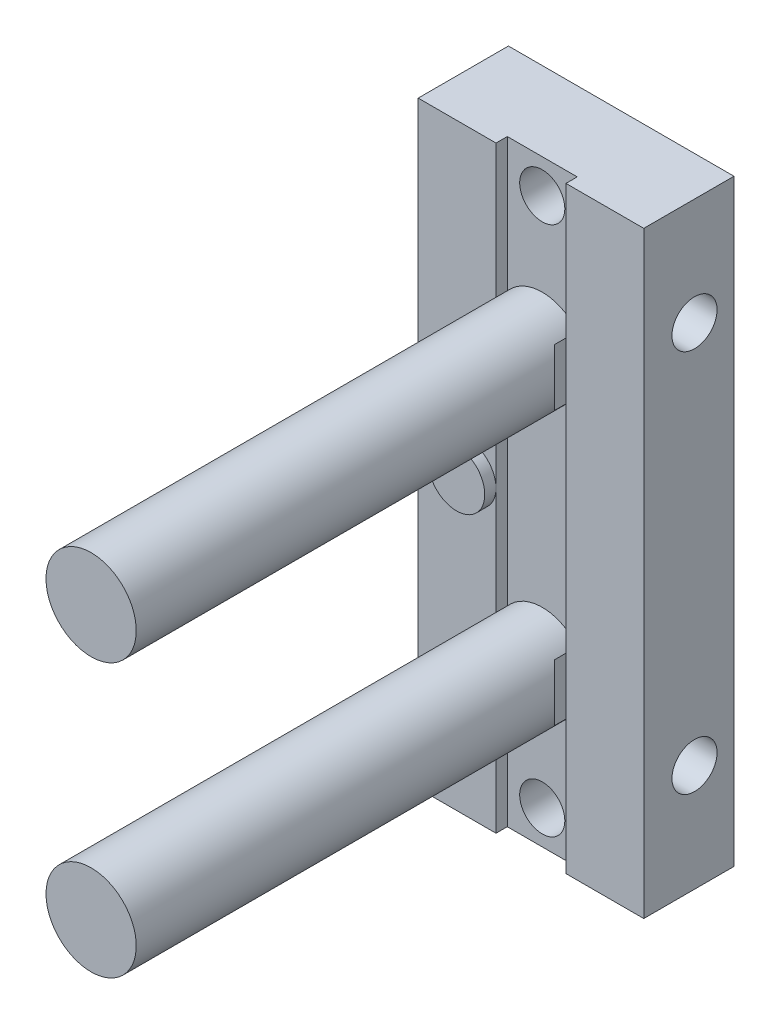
SolidWorks part; units mm, degrees
ref_plane "前视基准面" through (0, 0, 0) normal (0, 0, 1) x (1, 0, 0)
ref_plane "上视基准面" through (0, 0, 0) normal (0, 1, 0) x (1, 0, 0)
ref_plane "右视基准面" through (0, 0, 0) normal (1, 0, 0) x (0, 0, -1)
imported_body "输入1"
sketch "草图1" plane through (0, 27, 0) normal (0, 1, 0) x (-1, 0, 0)
  line L1 (11, 47) -> (-18.5375, 47)
  line L2 (11, 47) -> (11, 133.2865)
  line L3 (11, 133.2865) -> (-18.5375, 133.2865)
  line L4 (-18.5375, 47) -> (-18.5375, 133.2865)
extrude "切除-拉伸1" cut sketch "草图1" against normal through all
sketch "草图2" plane through (0, 0, 47) normal (0, 0, 1) x (1, 0, 0)
  circle A0 centre (-6.198, 0) radius 5.5303
extrude "切除-拉伸2" cut sketch "草图2" against normal blind 10
